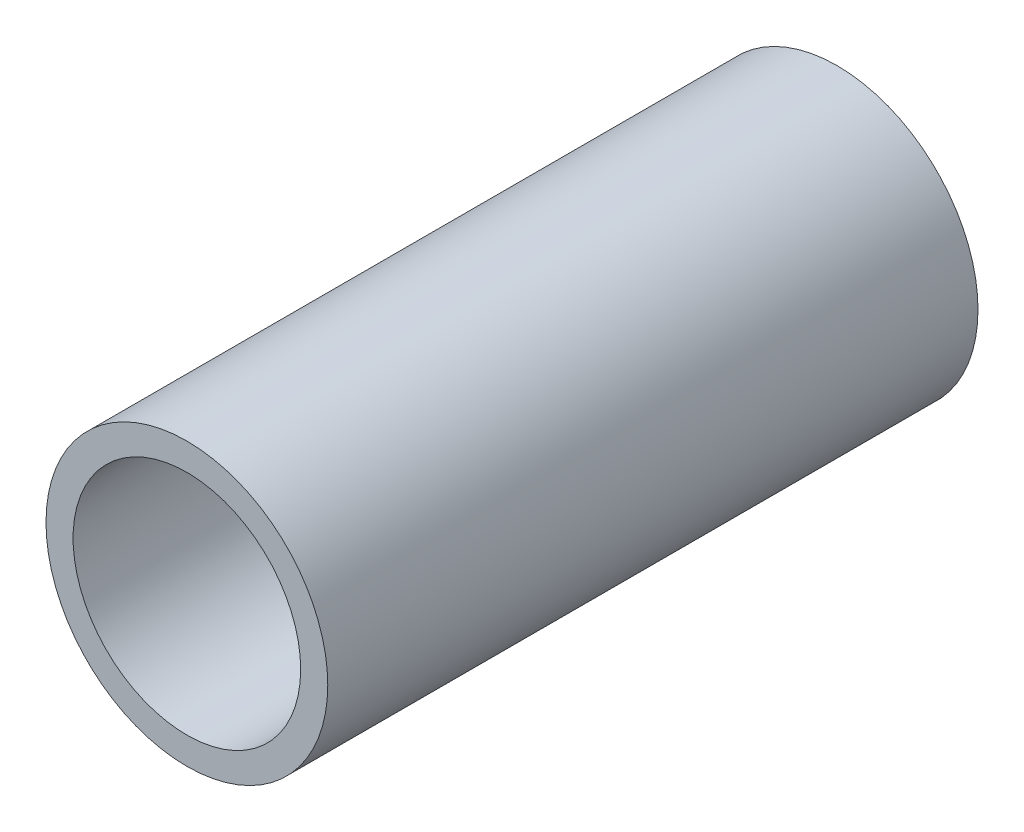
SolidWorks part; units mm, degrees
ref_plane "前视基准面" through (0, 0, 0) normal (0, 0, 1) x (1, 0, 0)
ref_plane "上视基准面" through (0, 0, 0) normal (0, 1, 0) x (1, 0, 0)
ref_plane "右视基准面" through (0, 0, 0) normal (1, 0, 0) x (0, 0, -1)
sketch "草图1" plane through (0, 0, 0) normal (0, 0, 1) x (1, 0, 0)
  circle A0 centre (0, 0) radius 13
  circle A1 centre (0, 0) radius 10.5
  dimension "D1" = 26
  dimension "D2" = 21
extrude "拉伸1" add sketch "草图1" along normal blind 60
sketch "草图2" plane through (0, 0, 0) normal (0, 1, 0) x (1, 0, 0)
  line L0 (0, 0) -> (0, -70.1798) construction
  line L1 (10.5, 0) -> (-10.5, 0) construction
  circle A0 centre (0, -25) radius 5.5
  dimension "D1" = 25
  dimension "D2" = 11
extrude "切除-拉伸1" cut sketch "草图2" against normal blind 60
